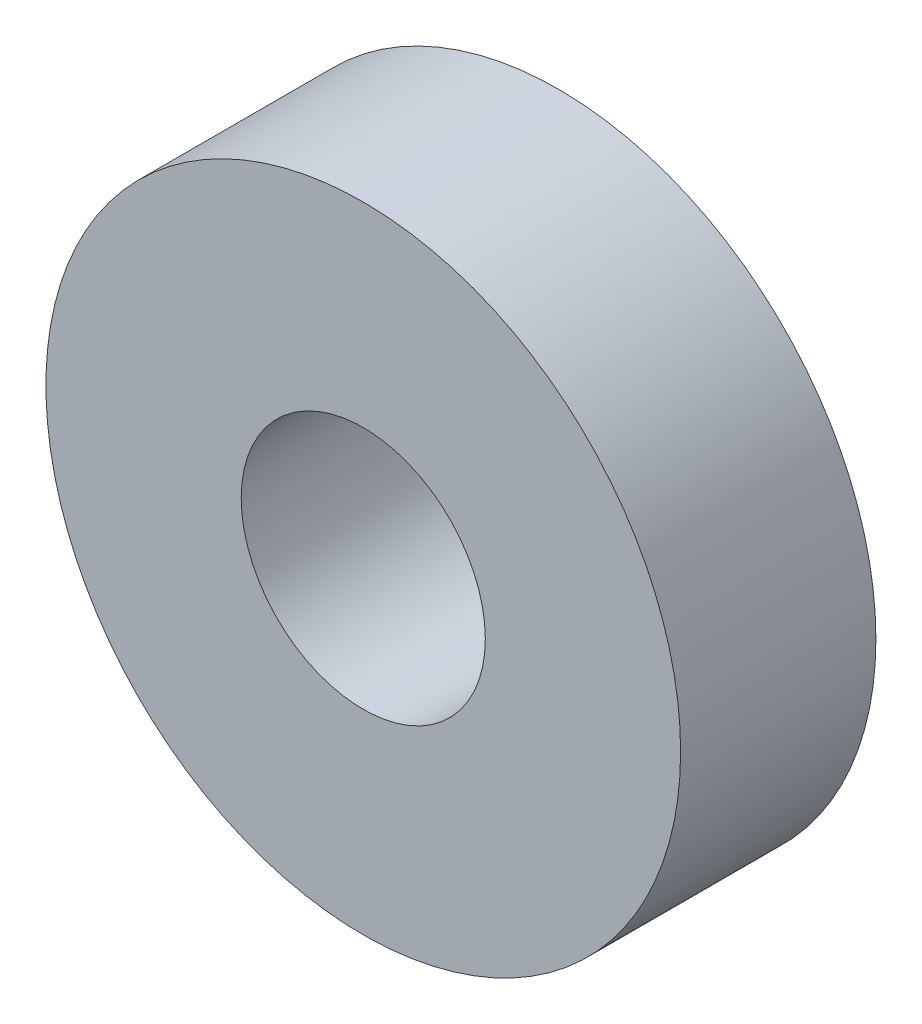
SolidWorks part; units mm, degrees
ref_plane "Plan1" through (0, 0, 0) normal (0, 0, 1) x (1, 0, 0)
ref_plane "Plan2" through (0, 0, 0) normal (0, 1, 0) x (1, 0, 0)
ref_plane "Plan3" through (0, 0, 0) normal (1, 0, 0) x (0, 0, -1)
sketch "Esquisse1" plane through (0, 0, 0) normal (0, 0, 1) x (1, 0, 0)
  circle A0 centre (0, 0) radius 13
  dimension "D2" = 26
extrude "Base-Extrusion" add sketch "Esquisse1" along normal blind 8
sketch "Esquisse2" plane through (0, 0, 8) normal (0, 0, 1) x (1, 0, 0)
  circle A0 centre (0, 0) radius 5
  circle A1 centre (0, 0) radius 13 construction
  dimension "D1" = 10
extrude "Enlèv. mat.-Extru.1" cut sketch "Esquisse2" against normal through all
